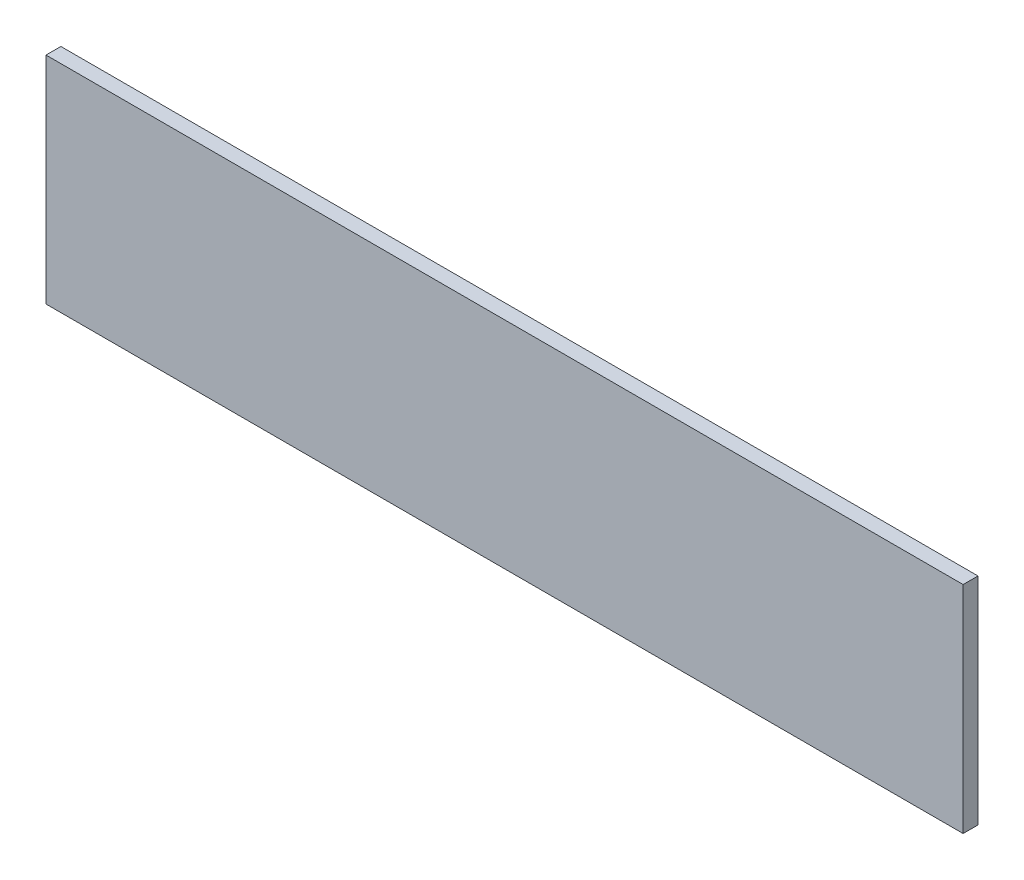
SolidWorks part; units mm, degrees
ref_plane "前视基准面" through (0, 0, 0) normal (0, 0, 1) x (1, 0, 0)
ref_plane "上视基准面" through (0, 0, 0) normal (0, 1, 0) x (1, 0, 0)
ref_plane "右视基准面" through (0, 0, 0) normal (1, 0, 0) x (0, 0, -1)
sketch "草图1" plane through (0, 0, 0) normal (0, 0, 1) x (1, 0, 0)
  line L1 (0, 0) -> (370, 0)
  line L2 (0, 0) -> (0, 87)
  line L3 (0, 87) -> (370, 87)
  line L4 (370, 0) -> (370, 87)
  dimension "D1" = 87
  dimension "D2" = 370
extrude "拉伸1" add sketch "草图1" along normal blind 6
